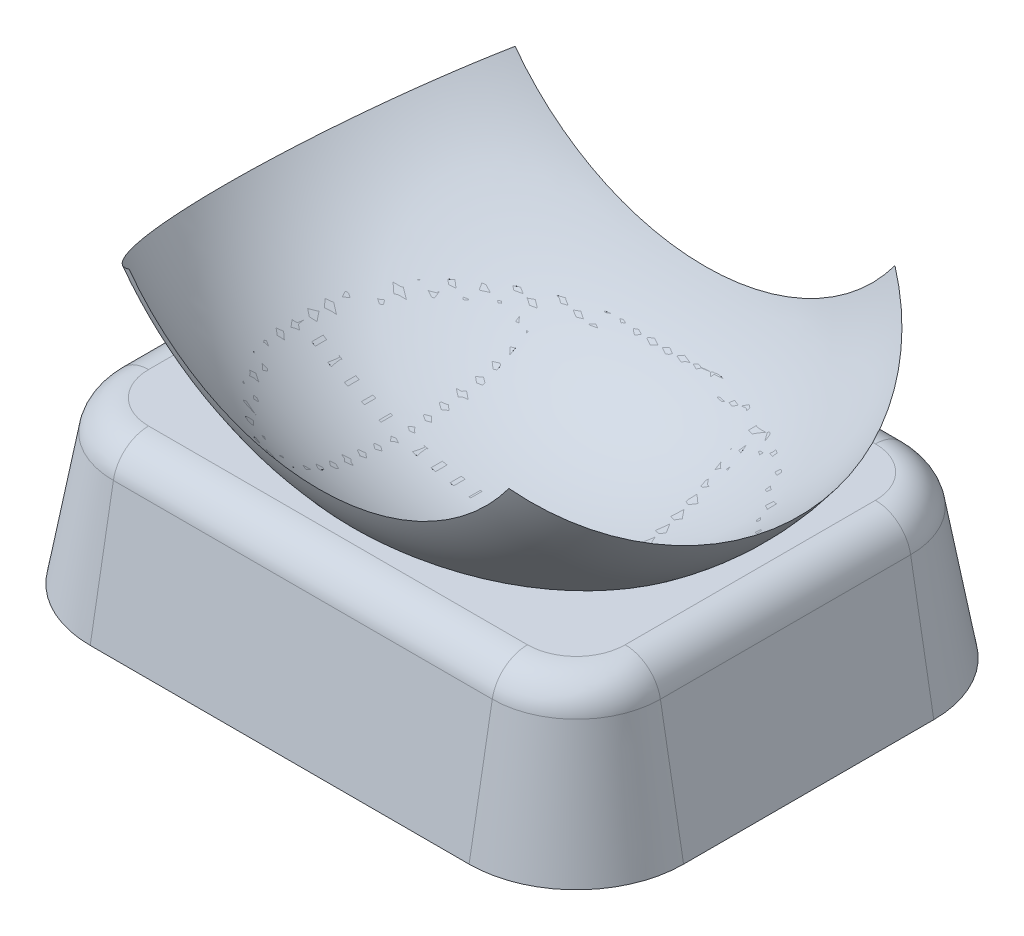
SolidWorks part; units mm, degrees
ref_plane "Front Plane" through (0, 0, 0) normal (0, 0, 1) x (1, 0, 0)
ref_plane "Top Plane" through (0, 0, 0) normal (0, 1, 0) x (1, 0, 0)
ref_plane "Right Plane" through (0, 0, 0) normal (1, 0, 0) x (0, 0, -1)
sketch "Sketch4" plane through (0, 0, 0) normal (0, 1, 0) x (1, 0, 0)
  line L0 (-52.705, -41.275) -> (52.705, 41.275) construction
  line L1 (-33.655, 41.275) -> (33.655, 41.275)
  line L2 (-52.705, 22.225) -> (-52.705, -22.225)
  line L3 (-33.655, -41.275) -> (33.655, -41.275)
  line L4 (52.705, 22.225) -> (52.705, -22.225)
  arc A0 (-52.705, -22.225) -> (-33.655, -41.275) centre (-33.655, -22.225) ccw
  arc A1 (-33.655, 41.275) -> (-52.705, 22.225) centre (-33.655, 22.225) ccw
  arc A2 (33.655, 41.275) -> (52.705, 22.225) centre (33.655, 22.225) cw
  arc A3 (33.655, -41.275) -> (52.705, -22.225) centre (33.655, -22.225) ccw
  point P10 (-52.705, 41.275)
  dimension "D3" = 19.05
  dimension "D1" = 105.41
  dimension "D2" = 82.55
extrude "Extrude1" add sketch "Sketch4" along normal blind 28.575 draft 10
fillet "Fillet3" radius 6.35 8 edges at (-43.5626, 28.575, 32.1326) (-47.6665, 28.575, 0) (-43.5626, 28.575, -32.1326) (0, 28.575, -36.2365) (43.5626, 28.575, -32.1326) (47.6665, 28.575, 0) (43.5626, 28.575, 32.1326) (0, 28.575, 36.2365)
shell "Shell1" thickness 1.651
ref_plane "Plane1" through (0, 14.224, 0) normal (0, -1, 0) x (1, 0, 0)
sketch "Sketch5" plane through (0, 14.224, 0) normal (0, -1, 0) x (1, 0, 0)
  line L0 (-40.2085, 0) -> (34.4333, 0)
  line L1 (-19.05, 29.3119) -> (-19.05, -21.3574)
  line L2 (19.05, -21.3574) -> (19.05, 29.3119)
  dimension "D1" = 19.05
  dimension "D2" = 19.05
rib "Rib1" sketch "Sketch5" sketch "Sketch5" thickness 2.032 extrusion direction normal to sketch draft on no parameters "D1"=2.032
sketch "Sketch7" plane through (0, 0, 0) normal (0, 0, 1) x (1, 0, 0)
  line L2 (-33.655, 28.575) -> (33.655, 28.575) construction
  arc A0 (51.0053, 41.5503) -> (-51.0053, 41.5503) centre (0, 79.375) cw
  dimension "D1" = 63.5
  dimension "D3" = 50.8
ref_plane "Plane2" through (51.0053, 41.5503, 0) normal (-0.5957, -0.8032, 0) x (0.8032, -0.5957, 0)
sketch "Sketch9" plane through (51.0053, 41.5503, 0) normal (-0.5957, -0.8032, 0) x (0.8032, -0.5957, 0)
  line L0 (0, 0) -> (-81.9383, 0) construction
  arc A0 (-21.4926, 34.29) -> (-21.4926, -34.29) centre (-38.1, 0) cw
  dimension "D1" = 38.1
surface "Surface-Sweep2"
other "Indent3" parameters "D1"=2, "D2"=0
